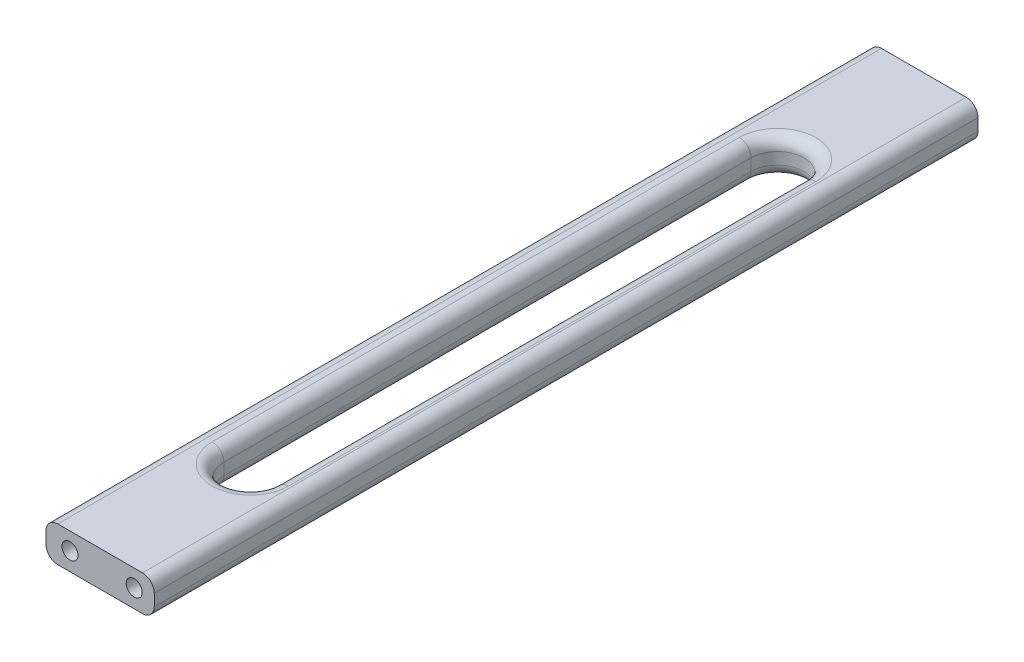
SolidWorks part; units mm, degrees
ref_plane "Plane1" through (0, 0, 0) normal (0, 0, 1) x (1, 0, 0)
ref_plane "Plane2" through (0, 0, 0) normal (0, 1, 0) x (1, 0, 0)
ref_plane "Plane3" through (0, 0, 0) normal (1, 0, 0) x (0, 0, -1)
sketch "Sketch3" plane through (0, 0, 0) normal (0, 0, 1) x (1, 0, 0)
  line L0 (0.323, -28.9034) -> (9.5529, -28.9034)
  line L2 (11.2645, -36.5234) -> (11.2645, -28.9034)
  line L3 (0.323, -28.9034) -> (-9.837, -28.9034)
  line L4 (9.5529, -28.9034) -> (11.2645, -28.9034)
  line L5 (-12.1035, -36.5234) -> (-12.1035, -28.9034)
  line L7 (11.2645, -36.5234) -> (-12.1035, -36.5234)
  line L8 (-9.837, -28.9034) -> (-12.1035, -28.9034)
extrude "Base-Extrude" add sketch "Sketch3" along normal blind 177.8
sketch "Sketch5" plane through (0, 0, 177.8) normal (0, 0, 1) x (1, 0, 0)
  line L0 (0, 0) -> (0, -41.656) construction
  circle A0 centre (6.9313, -32.609) radius 1.7272
  circle A1 centre (-6.9313, -32.609) radius 1.7272
extrude "Cut-Extrude1" cut sketch "Sketch5" against normal blind 15.875
sketch "Sketch6" plane through (0, 0, 0) normal (0, 0, -1) x (-1, 0, 0)
  circle A0 centre (-6.9313, -32.609) radius 1.7272
  circle A1 centre (6.9313, -32.609) radius 1.7272
extrude "Cut-Extrude2" cut sketch "Sketch6" against normal blind 15.875
fillet "Fillet1" radius 2.54
sketch "Sketch7" plane through (0, -36.5234, 0) normal (0, -1, 0) x (1, 0, 0)
  line L0 (5.715, 145.796) -> (5.715, 32.004)
  line L1 (-5.715, 145.796) -> (-5.715, 32.004)
  line L3 (11.2645, 88.9) -> (-18.288, 88.9) construction
  line L4 (11.2645, 177.8) -> (11.2645, 0) construction
  arc A0 (-5.715, 145.796) -> (5.715, 145.796) centre (0, 145.796) cw
  arc A1 (-5.715, 32.004) -> (5.715, 32.004) centre (0, 32.004) ccw
extrude "Cut-Extrude4" cut sketch "Sketch7" against normal mid plane 35.56
fillet "Fillet4" radius 2.54
